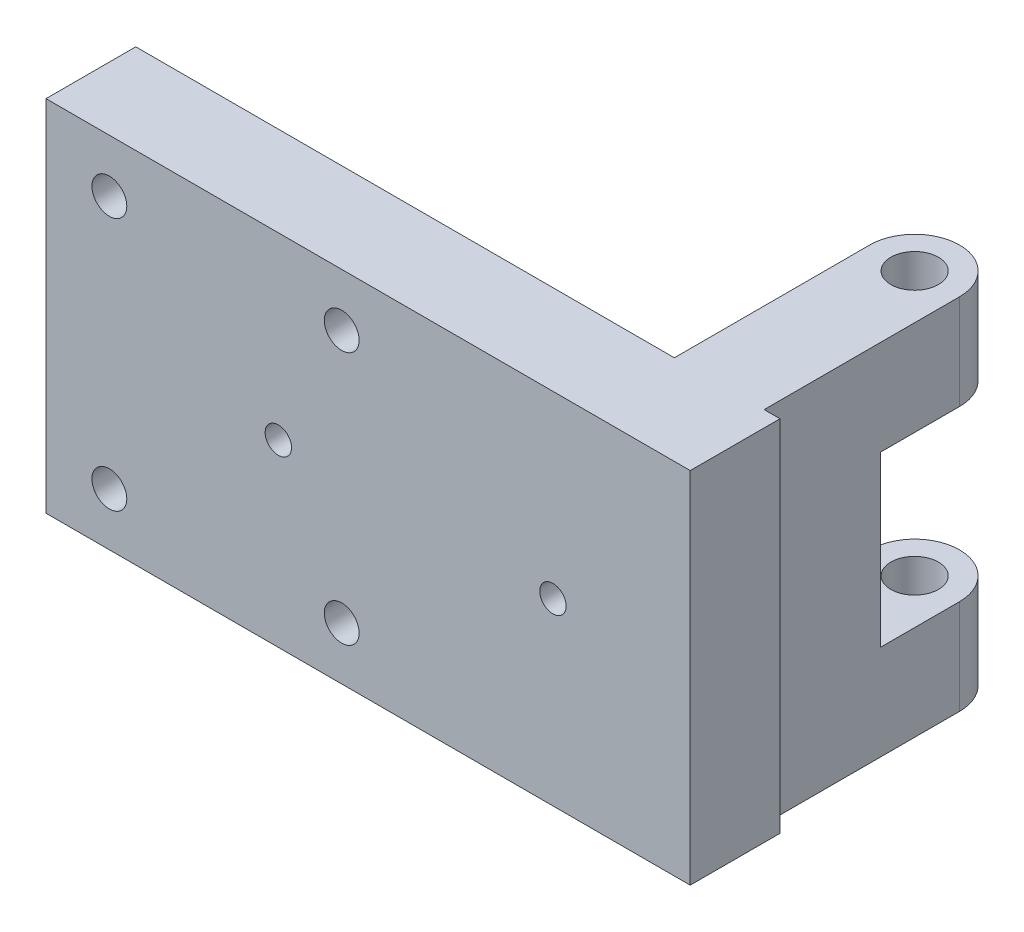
SolidWorks part; units mm, degrees
ref_plane "Face" through (0, 0, 0) normal (0, 0, 1) x (1, 0, 0)
ref_plane "Dessus" through (0, 0, 0) normal (0, 1, 0) x (1, 0, 0)
ref_plane "Droite" through (0, 0, 0) normal (1, 0, 0) x (0, 0, -1)
sketch "Esquisse1" plane through (0, 0, 0) normal (0, 0, 1) x (1, 0, 0)
  line L1 (0, 0) -> (122, 0)
  line L2 (0, 0) -> (0, 68)
  line L3 (0, 68) -> (122, 68)
  line L4 (122, 0) -> (122, 68)
  dimension "D1" = 122
  dimension "D2" = 68
extrude "Extrusion1" add sketch "Esquisse1" along normal blind 17
hole_wizard "Dégagement M61" positions "Esquisse3" profile "Esquisse2" hole size "M6" standard "ISO"
sketch "Esquisse3" plane through (0, 0, 17) normal (0, 0, 1) x (1, 0, 0)
  line L0 (0, 68) -> (0, 0) construction
  line L1 (0, 0) -> (122, 0) construction
  line L2 (122, 68) -> (0, 68) construction
  point P0 (12, 58)
  point P1 (56, 58)
  point P3 (56, 10)
  point P5 (12, 10)
  dimension "D1" = 12
  dimension "D2" = 12
  dimension "D3" = 44
  dimension "D4" = 44
  dimension "D5" = 10
  dimension "D6" = 10
  dimension "D7" = 10
  dimension "D8" = 10
sketch "Esquisse2" plane through (12, 58, 17) normal (1, 0, 0) x (0, -1, 0)
  line L0 (0, 0) -> (0, 17)
  line L1 (0, 17) -> (3.3, 17)
  line L2 (3.3, 17) -> (3.3, 0)
  line L5 (3.3, 0) -> (0, 0)
  line L11 (0, -6.35) -> (0, 107.95) construction
  dimension "Diamètre du perçage jusqu'au prochain" = 6.6
  dimension "Profondeur du perçage jusqu'au prochain" = 17
hole_wizard "Trou taraudé M61" positions "Esquisse5" profile "Esquisse4" tap size "M6" standard "ISO"
sketch "Esquisse5" plane through (0, 0, 17) normal (0, 0, 1) x (1, 0, 0)
  line L0 (122, 68) -> (0, 68) construction
  line L1 (0, 0) -> (122, 0) construction
  line L2 (122, 0) -> (122, 68) construction
  point P0 (44, 34)
  point P1 (96, 34)
  dimension "D1" = 34
  dimension "D2" = 34
  dimension "D3" = 52
  dimension "D4" = 26
sketch "Esquisse4" plane through (44, 34, 17) normal (1, 0, 0) x (0, -1, 0)
  line L0 (0, 0) -> (0, 17)
  line L1 (0, 17) -> (2.5, 17)
  line L2 (2.5, 17) -> (2.5, 0)
  line L5 (2.5, 0) -> (0, 0)
  line L11 (0, -6.35) -> (0, 107.95) construction
  dimension "Diamètre du trou pour taraudage jusqu'au prochain" = 5
  dimension "Profondeur du trou pour taraudage jusqu'au prochain" = 17
sketch "Esquisse6" plane through (0, 0, 0) normal (0, -1, 0) x (1, 0, 0)
  line L0 (119, 0) -> (119, -37)
  line L1 (102, 0) -> (102, -37)
  line L2 (0, 0) -> (122, 0) construction
  line L3 (102, 0) -> (119, 0)
  arc A0 (119, -37) -> (102, -37) centre (110.5, -37) cw
  circle A1 centre (110.5, -37) radius 4.5
  dimension "D4" = 9
  dimension "D1" = 17
  dimension "D2" = 3
  dimension "D3" = 37
extrude "Extrusion2" add sketch "Esquisse6" against normal blind 18
ref_plane "Plan1" through (0, 34, 0) normal (0, -1, 0) x (1, 0, 0)
mirror "Symétrie1" about plane through (0, 34, 0) normal (0, -1, 0) of "Extrusion2"
sketch "Esquisse7" plane through (119, 0, 0) normal (1, 0, 0) x (0, 0, -1)
  line L0 (37, 18) -> (0, 18) construction
  line L1 (0, 50) -> (22, 50)
  line L2 (0, 50) -> (0, 18)
  line L3 (0, 18) -> (22, 18)
  line L4 (22, 50) -> (22, 18)
  dimension "D1" = 22
extrude "Extrusion3" add sketch "Esquisse7" against normal up to surface (17 mm away)
